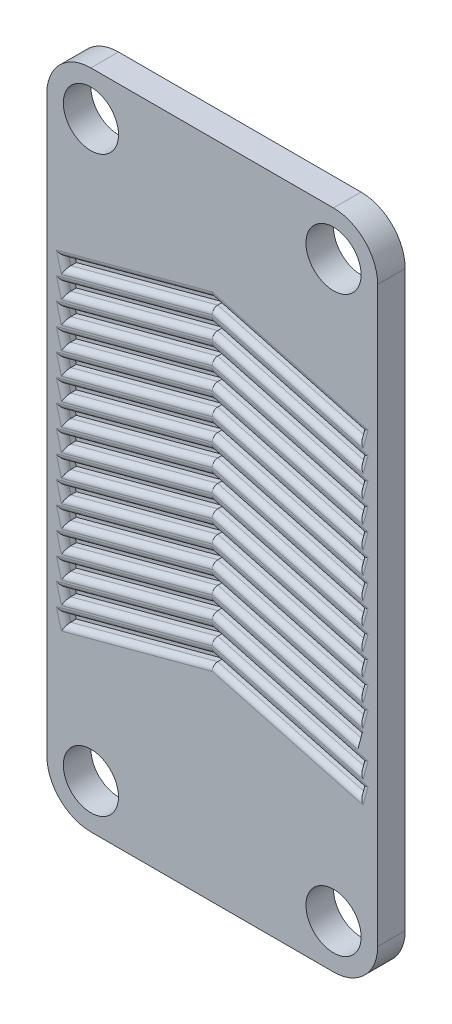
SolidWorks part; units mm, degrees
ref_plane "Plan de face" through (0, 0, 0) normal (0, 0, 1) x (1, 0, 0)
ref_plane "Plan de dessus" through (0, 0, 0) normal (0, 1, 0) x (1, 0, 0)
ref_plane "Plan de droite" through (0, 0, 0) normal (1, 0, 0) x (0, 0, -1)
sketch "Esquisse1" plane through (0, 0, 0) normal (0, 0, 1) x (1, 0, 0)
  line L1 (-220, -600) -> (220, -600)
  line L2 (-300, -520) -> (-300, 520)
  line L3 (-220, 600) -> (220, 600)
  line L4 (300, -520) -> (300, 520)
  line L5 (-300, -600) -> (300, 600) construction
  line L6 (-300, 600) -> (300, -600) construction
  arc A0 (-300, -520) -> (-220, -600) centre (-220, -520) ccw
  arc A1 (220, -600) -> (300, -520) centre (220, -520) ccw
  arc A2 (300, 520) -> (220, 600) centre (220, 520) ccw
  arc A3 (-300, 520) -> (-220, 600) centre (-220, 520) cw
  circle A4 centre (-220, 520) radius 50
  circle A5 centre (220, 520) radius 50
  circle A6 centre (-220, -520) radius 50
  circle A7 centre (220, -520) radius 50
  point P0 (0, 0)
  dimension "D3" = 80
  dimension "D4" = 100
  dimension "D1" = 1200
  dimension "D2" = 600
  dimension "D6" = 80
  dimension "D7" = 80
  dimension "D9" = 80
  dimension "D5" = 2
  dimension "D8" = 2
extrude "Boss.-Extru.1" add sketch "Esquisse1" along normal blind 50
sketch "Esquisse2" plane through (0, 0, 50) normal (0, 0, 1) x (1, 0, 0)
  line L0 (0, 600) -> (0, -617.3954) construction
  line L1 (220, 600) -> (-220, 600) construction
  line L2 (-270.4592, 275.5307) -> (0, 348)
  line L3 (0, 348) -> (270.4592, 275.5307)
  line L4 (-266.5769, 261.0418) -> (0, 332.4709)
  line L5 (0, 332.4709) -> (266.5769, 261.0418)
  line L6 (-270.4592, 275.5307) -> (-266.5769, 261.0418)
  line L7 (270.4592, 275.5307) -> (266.5769, 261.0418)
  dimension "D1" = 15
  dimension "D2" = 15
  dimension "D3" = 280
  dimension "D4" = 280
  dimension "D5" = 252
  dimension "D6" = 15
extrude "Enlèv. mat.-Extru.1" cut sketch "Esquisse2" against normal blind 20
fillet "Congé1" radius 10 4 edges at (-135.2296, 311.7653, 50) (-133.2885, 296.7563, 50) (133.2885, 296.7563, 50) (135.2296, 311.7653, 50)
pattern_linear "Répétition linéaire1" count 15 spacing 40 along (0, -1, 0) of "Enlèv. mat.-Extru.1", "Congé1"
ref_plane "Plan médiant plaque" through (0, 0, 25) normal (0, 0, 1) x (1, 0, 0)
mirror "Symétrie2" about plane through (0, 0, 25) normal (0, 0, 1) of "Enlèv. mat.-Extru.1"
pattern_linear "Répétition linéaire2" count 15 spacing 40 along (0, -1, 0) of "Symétrie2"
fillet "Congé2" radius 10 5 edges at (133.2885, 296.7563, 0) (135.2296, 311.7653, 20) (-133.2885, 296.7563, 0) (-135.2296, 311.7653, 0) (135.2296, 311.7653, 0)
fillet "Congé3" radius 10 1 edges at (268.5181, 268.2862, 0)
fillet "Congé4" radius 10 1 edges at (-268.5181, 268.2862, 0)
fillet "Congé5" radius 10 55 edges at (-133.2885, -263.2437, 0) (-135.2296, -248.2347, 0) (-133.2885, -223.2437, 0) (-135.2296, -208.2347, 0) (-133.2885, -183.2437, 0) (-135.2296, -168.2347, 0) (-133.2885, -143.2437, 0) (-135.2296, -128.2347, 0) (-133.2885, -103.2437, 0) (-135.2296, -88.2347, 0) (-133.2885, -63.2437, 0) (-135.2296, -48.2347, 0) (-133.2885, -23.2437, 0) (-135.2296, -8.2347, 0) (-133.2885, 16.7563, 0) (-135.2296, 31.7653, 0) (-133.2885, 56.7563, 0) (-135.2296, 71.7653, 0) (-133.2885, 96.7563, 0) (-135.2296, 111.7653, 0) (-133.2885, 136.7563, 0) (-135.2296, 151.7653, 0) (-133.2885, 176.7563, 0) (-135.2296, 191.7653, 0) (-133.2885, 216.7563, 0) (-135.2296, 231.7653, 0) (-133.2885, 256.7563, 0) (-135.2296, 271.7653, 0) (133.2885, -263.2437, 0) (135.2296, -248.2347, 0) (133.2885, -223.2437, 0) (135.2296, -208.2347, 0) (133.2885, -183.2437, 0) (135.2296, -168.2347, 0) (135.2296, -128.2347, 0) (133.2885, -103.2437, 0) (135.2296, -88.2347, 0) (133.2885, -63.2437, 0) (135.2296, -48.2347, 0) (133.2885, -23.2437, 0) (135.2296, -8.2347, 0) (133.2885, 16.7563, 0) (135.2296, 31.7653, 0) (133.2885, 56.7563, 0) (135.2296, 71.7653, 0) (133.2885, 96.7563, 0) (135.2296, 111.7653, 0) (133.2885, 136.7563, 0) (135.2296, 151.7653, 0) (133.2885, 176.7563, 0) (135.2296, 191.7653, 0) (133.2885, 216.7563, 0) (135.2296, 231.7653, 0) (133.2885, 256.7563, 0) (135.2296, 271.7653, 0)
fillet "Congé6" radius 10 28 edges at (268.5181, 228.2862, 0) (268.5181, 188.2862, 0) (268.5181, 148.2862, 0) (268.5181, 108.2862, 0) (268.5181, 68.2862, 0) (268.5181, 28.2862, 0) (268.5181, -11.7138, 0) (268.5181, -51.7138, 0) (268.5181, -91.7138, 0) (268.5181, -131.7138, 0) (269.8122, -166.8841, 0) (268.5181, -211.7138, 0) (268.5181, -251.7138, 0) (268.5181, -291.7138, 0) (-268.5181, -291.7138, 0) (-268.5181, -251.7138, 0) (-268.5181, -211.7138, 0) (-268.5181, -171.7138, 0) (-268.5181, -131.7138, 0) (-268.5181, -91.7138, 0) (-268.5181, -51.7138, 0) (-268.5181, -11.7138, 0) (-268.5181, 28.2862, 0) (-268.5181, 68.2862, 0) (-268.5181, 108.2862, 0) (-268.5181, 148.2862, 0) (-268.5181, 188.2862, 0) (-268.5181, 228.2862, 0)
fillet "Congé7" radius 10 29 edges at (-268.5181, 268.2862, 50) (-268.5181, 228.2862, 50) (-268.5181, 188.2862, 50) (-268.5181, 148.2862, 50) (-268.5181, 108.2862, 50) (-268.5181, 68.2862, 50) (-268.5181, 28.2862, 50) (-268.5181, -11.7138, 50) (-268.5181, -51.7138, 50) (-268.5181, -91.7138, 50) (-268.5181, -131.7138, 50) (-268.5181, -171.7138, 50) (-268.5181, -211.7138, 50) (-268.5181, -251.7138, 50) (-268.5181, -291.7138, 50) (268.5181, -291.7138, 50) (268.5181, -251.7138, 50) (268.5181, -171.7138, 50) (268.5181, -131.7138, 50) (268.5181, -91.7138, 50) (268.5181, -51.7138, 50) (268.5181, -11.7138, 50) (268.5181, 28.2862, 50) (268.5181, 68.2862, 50) (268.5181, 108.2862, 50) (268.5181, 148.2862, 50) (268.5181, 188.2862, 50) (268.5181, 228.2862, 50) (268.5181, 268.2862, 50)
sketch "Esquisse3" plane through (0, 0, 50) normal (0, 0, 1) x (1, 0, 0)
  line L4 (-220, -600) -> (220, -600)
  line L5 (300, -520) -> (300, 520)
  line L6 (220, 600) -> (-220, 600)
  line L7 (-300, 520) -> (-300, -520)
  line L8 (-220, -600) -> (220, -600)
  line L9 (300, -520) -> (300, 520)
  line L10 (220, 600) -> (-220, 600)
  line L11 (-300, 520) -> (-300, -520)
  circle A0 centre (-220, -520) radius 50 construction
  circle A1 centre (220, -520) radius 50 construction
  circle A2 centre (220, 520) radius 50 construction
  circle A3 centre (-220, 520) radius 50 construction
  arc A4 (-300, -520) -> (-220, -600) centre (-220, -520) ccw
  arc A5 (220, -600) -> (300, -520) centre (220, -520) ccw
  arc A6 (300, 520) -> (220, 600) centre (220, 520) ccw
  arc A7 (-220, 600) -> (-300, 520) centre (-220, 520) ccw
  arc A8 (-300, -520) -> (-220, -600) centre (-220, -520) ccw
  arc A9 (220, -600) -> (300, -520) centre (220, -520) ccw
  arc A10 (300, 520) -> (220, 600) centre (220, 520) ccw
  arc A11 (-220, 600) -> (-300, 520) centre (-220, 520) ccw
  circle A12 centre (-220, -520) radius 50
  circle A13 centre (220, -520) radius 50
  circle A14 centre (220, 520) radius 50
  circle A15 centre (-220, 520) radius 50
  dimension "D1" = 0
